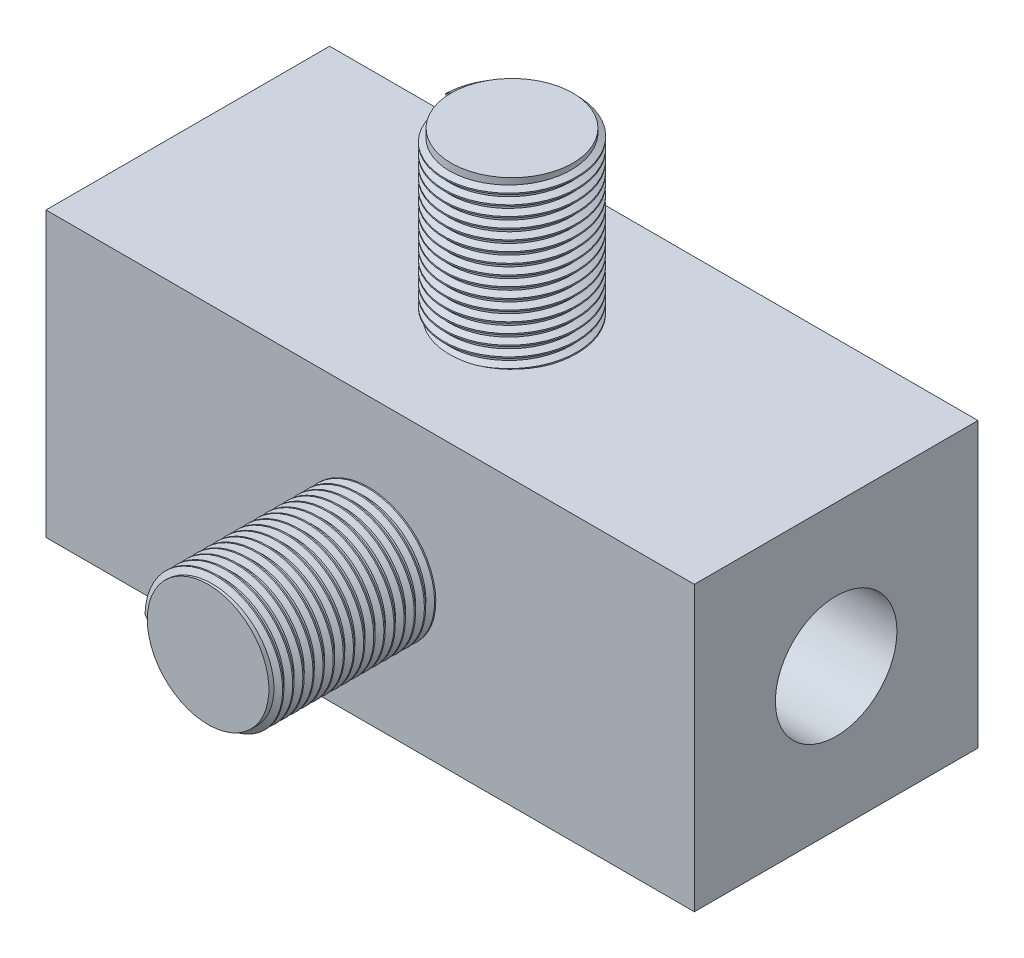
SolidWorks part; units mm, degrees
ref_plane "Front Plane" through (0, 0, 0) normal (0, 0, 1) x (1, 0, 0)
ref_plane "Top Plane" through (0, 0, 0) normal (0, 1, 0) x (1, 0, 0)
ref_plane "Right Plane" through (0, 0, 0) normal (1, 0, 0) x (0, 0, -1)
sketch "Sketch1" plane through (0, 0, 0) normal (0, 0, 1) x (1, 0, 0)
  line L1 (-50.8, 22.225) -> (50.8, 22.225)
  line L2 (-50.8, 22.225) -> (-50.8, -22.225)
  line L3 (-50.8, -22.225) -> (50.8, -22.225)
  line L4 (50.8, 22.225) -> (50.8, -22.225)
  line L5 (-50.8, 22.225) -> (50.8, -22.225) construction
  line L6 (-50.8, -22.225) -> (50.8, 22.225) construction
  point P0 (0, 0)
  dimension "D1" = 101.6
  dimension "D2" = 44.45
extrude "Boss-Extrude1" add sketch "Sketch1" along normal blind 44.45
sketch "Sketch3" plane through (0, 0, 0) normal (1, 0, 0) x (0, 0, -1)
  line L0 (0, -22.225) -> (0, 22.225) construction
  line L1 (-44.45, -22.225) -> (0, -22.225) construction
  circle A0 centre (-22.225, 0) radius 9.525
  dimension "D1" = 19.05
  dimension "D2" = 22.225
  dimension "D3" = 22.225
extrude "Cut-Extrude2" cut sketch "Sketch3" against normal through all both and the other way through all
ref_plane "Plane1" through (0, 22.225, 0) normal (0, 1, 0) x (1, 0, 0)
sketch "Sketch4" plane through (0, 22.225, 0) normal (0, 1, 0) x (1, 0, 0)
  line L0 (50.8, 0) -> (-50.8, 0) construction
  line L1 (50.8, -44.45) -> (50.8, 0) construction
  circle A0 centre (0, -22.225) radius 9.525
  dimension "D1" = 19.05
  dimension "D2" = 22.225
  dimension "D3" = 50.8
extrude "Boss-Extrude2" add sketch "Sketch4" along normal blind 25.4
sketch "Sketch5" plane through (0, 0, 44.45) normal (0, 0, 1) x (1, 0, 0)
  circle A0 centre (0, 0) radius 9.525
  dimension "D1" = 19.05
extrude "Boss-Extrude3" add sketch "Sketch5" along normal blind 25.4
thread "Thread1" pitch 1.5875 start angle 0, offset 0, length 25.4, pitch 1.5875, diameter 19.05
ref_plane "Plane2" through (-9.525, 0, 69.85) normal (0, -1, 0) x (-1, 0, 0)
sketch "Thread Profile1" plane through (-9.525, 0, 69.85) normal (0, -1, 0) x (-1, 0, 0)
  line L0 (0, 0) -> (0, 1.5875) construction
  line L1 (0, 0) -> (0.8593, 0.4961)
  line L2 (0.8593, 0.4961) -> (0.8593, 0.6945)
  line L3 (0.8593, 0.6945) -> (0, 1.1906)
  line L4 (0.8593, 0.5953) -> (0, 0.5953) construction
  line L11 (0, 0) -> (0, 1.1906)
  point P2 (0, 0)
  dimension "Pitch" = 1.5875
  dimension "Profile_Angle" = 60
  dimension "Profile_Land" = 0.1984
  dimension "Profile_Height" = 0.8593
thread "Thread2" pitch 1.5875 start angle 0, offset 0, length 25.4, pitch 1.5875, diameter 19.05
ref_plane "Plane3" through (-9.525, 47.625, 22.225) normal (0, 0, 1) x (-1, 0, 0)
sketch "Thread Profile2" plane through (-9.525, 47.625, 22.225) normal (0, 0, 1) x (-1, 0, 0)
  line L0 (0, 0) -> (0, 1.5875) construction
  line L1 (0, 0) -> (0.8593, 0.4961)
  line L2 (0.8593, 0.4961) -> (0.8593, 0.6945)
  line L3 (0.8593, 0.6945) -> (0, 1.1906)
  line L4 (0.8593, 0.5953) -> (0, 0.5953) construction
  line L11 (0, 0) -> (0, 1.1906)
  point P2 (0, 0)
  dimension "Pitch" = 1.5875
  dimension "Profile_Angle" = 60
  dimension "Profile_Land" = 0.1984
  dimension "Profile_Height" = 0.8593
